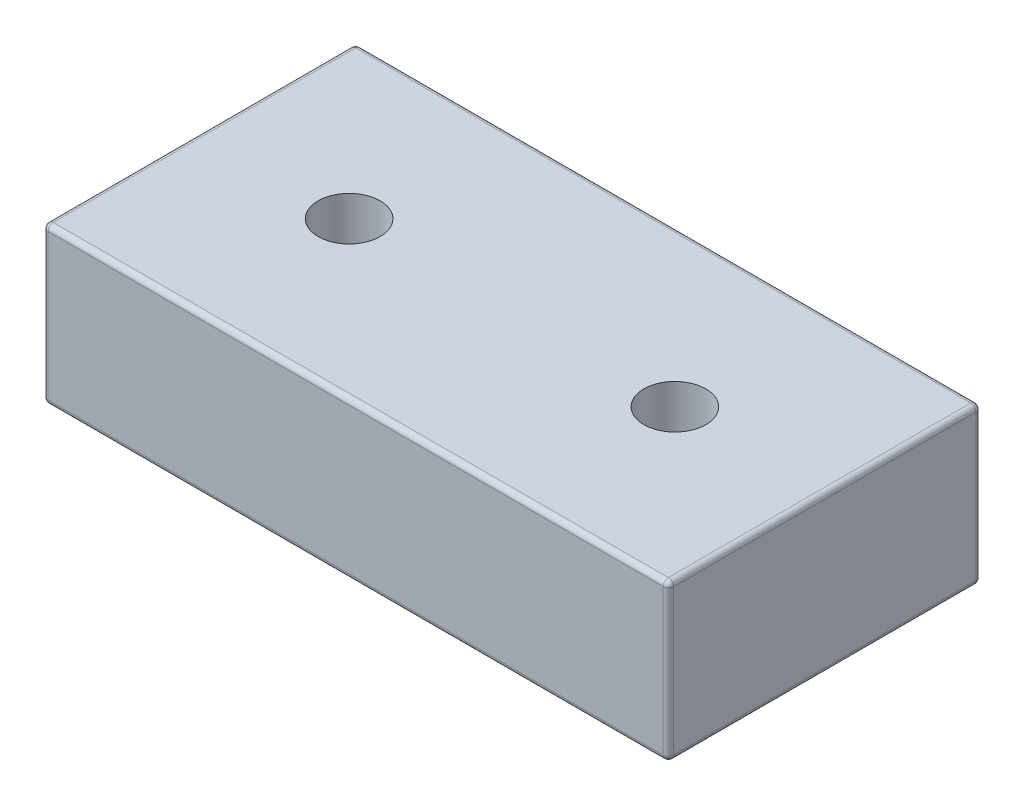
SolidWorks part; units mm, degrees
ref_plane "Front Plane" through (0, 0, 0) normal (0, 0, 1) x (1, 0, 0)
ref_plane "Top Plane" through (0, 0, 0) normal (0, 1, 0) x (1, 0, 0)
ref_plane "Right Plane" through (0, 0, 0) normal (1, 0, 0) x (0, 0, -1)
sketch "Sketch1" plane through (0, 0, 0) normal (0, 1, 0) x (1, 0, 0)
  line L1 (304.8, 152.4) -> (-304.8, 152.4)
  line L2 (304.8, 152.4) -> (304.8, -152.4)
  line L3 (304.8, -152.4) -> (-304.8, -152.4)
  line L4 (-304.8, 152.4) -> (-304.8, -152.4)
  dimension "D1" = 609.6
  dimension "D2" = 304.8
  dimension "D3" = 152.4
  dimension "D4" = 304.8
extrude "Extrude1" add sketch "Sketch1" along normal mid plane 152.4
sketch "Sketch2" plane through (0, 76.2, 0) normal (0, 1, 0) x (-1, 0, 0)
  circle A0 centre (158.75, 0) radius 7.62
  circle A1 centre (-158.75, 0) radius 7.62
  dimension "D1" = 15.24
  dimension "D2" = 158.75
  dimension "D3" = 158.75
extrude "Cut-Extrude1" cut sketch "Sketch2" against normal through all
fillet "Fillet1" radius 5.08 4 edges at (304.8, 76.2, 0) (0, 76.2, 152.4) (0, 76.2, -152.4) (-304.8, 76.2, 0)
fillet "Fillet2" radius 5.08 4 edges at (-304.8, -76.2, 0) (0, -76.2, 152.4) (304.8, -76.2, 0) (0, -76.2, -152.4)
fillet "Fillet3" radius 5.08 3 edges at (-303.3121, 74.7121, -150.9121) (-303.3121, -74.7121, -150.9121) (-304.8, 0, -152.4)
fillet "Fillet4" radius 5.08 3 edges at (-303.3121, 74.7121, 150.9121) (-303.3121, -74.7121, 150.9121) (-304.8, 0, 152.4)
fillet "Fillet5" radius 5.08 6 edges at (303.3121, 74.7121, -150.9121) (303.3121, -74.7121, -150.9121) (303.3121, 74.7121, 150.9121) (303.3121, -74.7121, 150.9121) (304.8, 0, -152.4) (304.8, 0, 152.4)
sketch "Sketch3" plane through (0, -76.2, 0) normal (0, -1, 0) x (1, 0, 0)
  circle A0 centre (-158.75, 0) radius 30.226
  dimension "D1" = 60.452
extrude "Cut-Extrude2" cut sketch "Sketch3" against normal through all
sketch "Sketch4" plane through (0, -76.2, 0) normal (0, -1, 0) x (1, 0, 0)
  circle A0 centre (158.75, 0) radius 30.226
  dimension "D1" = 60.452
extrude "Cut-Extrude3" cut sketch "Sketch4" against normal through all
